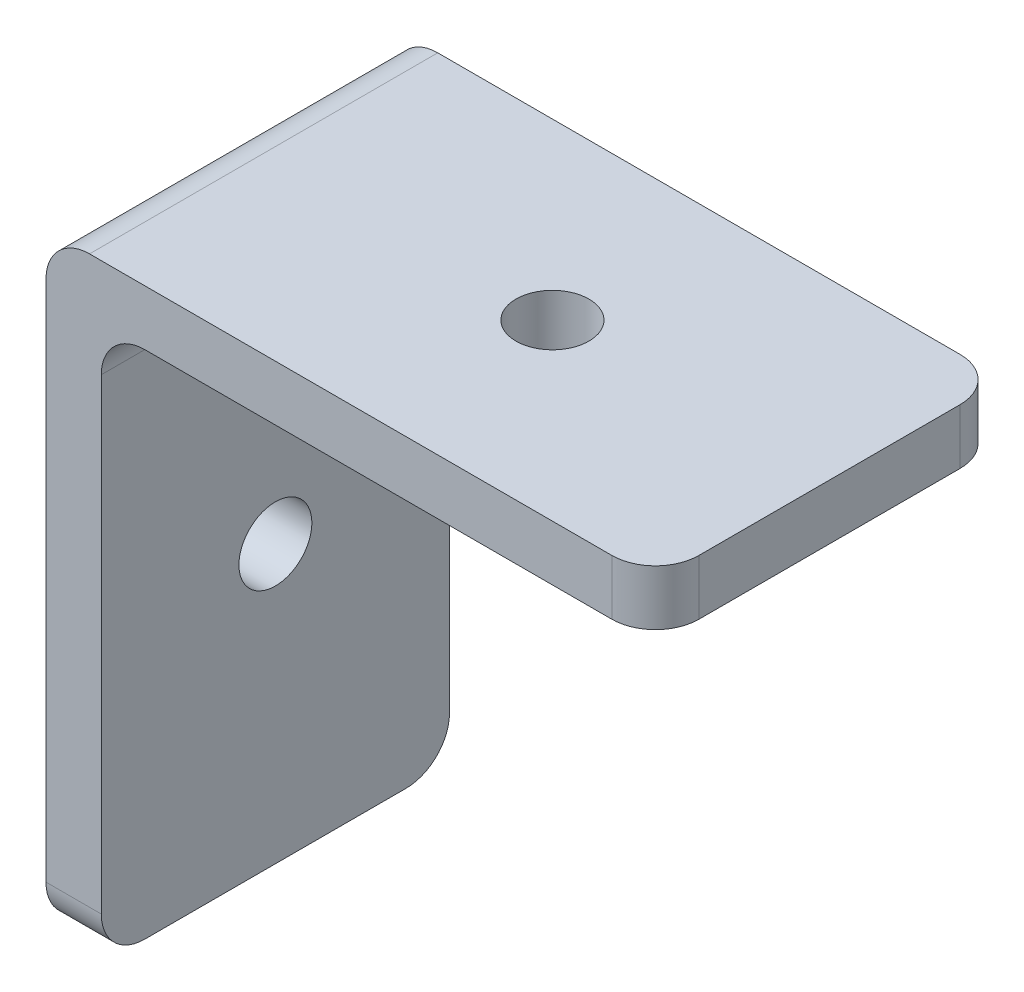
SolidWorks part; units mm, degrees
ref_plane "Front Plane" through (0, 0, 0) normal (0, 0, 1) x (1, 0, 0)
ref_plane "Top Plane" through (0, 0, 0) normal (0, 1, 0) x (1, 0, 0)
ref_plane "Right Plane" through (0, 0, 0) normal (1, 0, 0) x (0, 0, -1)
sketch "Sketch1" plane through (0, 0, 0) normal (0, 0, 1) x (1, 0, 0)
  line L0 (270, 215) -> (-10, 215) construction
  line L2 (45, 215) -> (10, 215)
  line L3 (10, 215) -> (10, 180)
  line L4 (45, 211.825) -> (10, 211.825)
  line L5 (13.175, 215) -> (13.175, 180)
  line L6 (13.175, 180) -> (10, 180)
  line L7 (45, 211.825) -> (45, 215)
  line L8 (13.175, 215) -> (13.175, 0) construction
  line L9 (10, 215) -> (10, 0) construction
  line L10 (270, 211.825) -> (-10, 211.825) construction
  line L11 (270, 215) -> (-10, 215) construction
  dimension "D3" = 35
  dimension "D4" = 35
  dimension "D1" = 3.175
  dimension "D2" = 3.175
extrude "Boss-Extrude1" add sketch "Sketch1" against normal up to surface (20 mm away) contours L5 L2 L3 L4 | L4 L7 L2 L5 | L6 L5 L4 L3
sketch "Sketch2" plane through (13.175, 0, 0) normal (1, 0, 0) x (0, 0, -1)
  line L0 (10, 211.825) -> (10, 180) construction
  line L4 (0, 180) -> (20, 180)
  line L5 (20, 180) -> (20, 211.825)
  line L6 (20, 211.825) -> (0, 211.825)
  line L7 (0, 211.825) -> (0, 180)
  line L8 (0, 180) -> (20, 180) construction
  line L9 (20, 180) -> (20, 211.825) construction
  line L10 (20, 211.825) -> (0, 211.825) construction
  line L11 (0, 211.825) -> (0, 180) construction
  circle A0 centre (10, 195.9125) radius 2.095
  dimension "D2" = 4.19
  dimension "D1" = 0
extrude "Cut-Extrude1" cut sketch "Sketch2" against normal through all
fillet "Fillet1" radius 2.5 6 edges at (10, 215, -10) (13.175, 211.825, -10) (11.5875, 180, -20) (11.5875, 180, 0) (45, 213.4125, -20) (45, 213.4125, 0)
ref_plane "Plane1" through (112.5, 112.5, 0) normal (0.7071, 0.7071, 0) x (0.7071, -0.7071, 0)
mirror "Mirror1" about plane through (112.5, 112.5, 0) normal (0.7071, 0.7071, 0) of "Cut-Extrude1"
